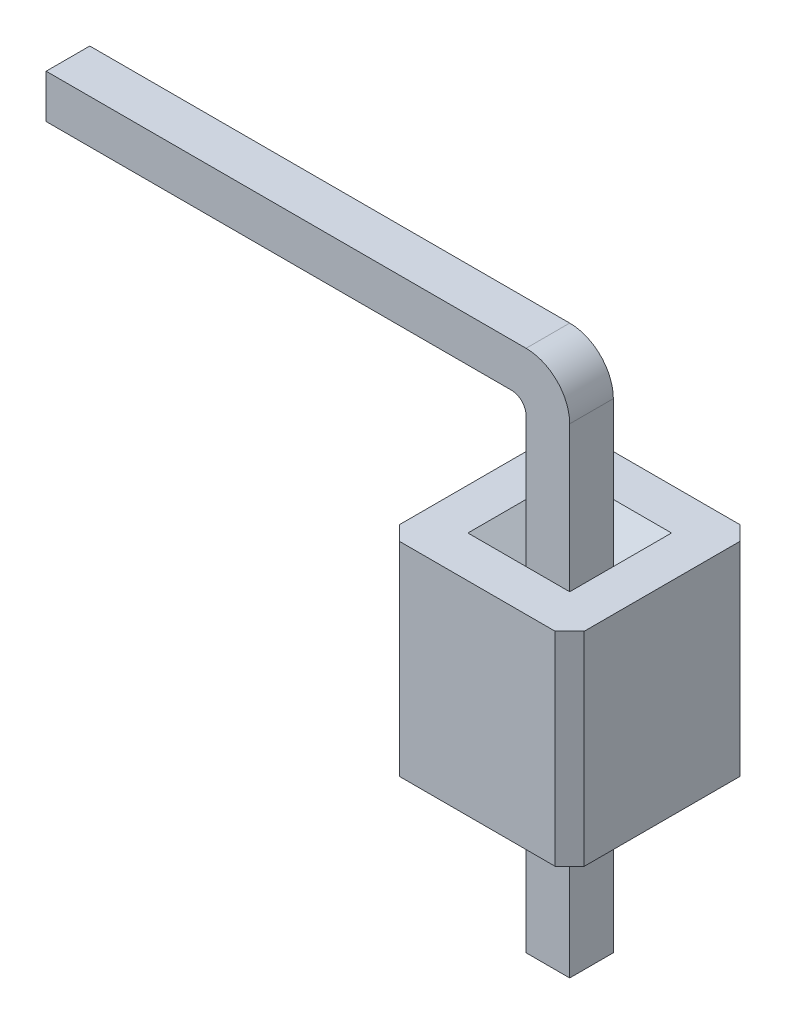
SolidWorks part; units mm, degrees
ref_plane "Plan de face" through (0, 0, 0) normal (0, 0, 1) x (1, 0, 0)
ref_plane "Plan de dessus" through (0, 0, 0) normal (0, 1, 0) x (1, 0, 0)
ref_plane "Plan de droite" through (0, 0, 0) normal (1, 0, 0) x (0, 0, -1)
sketch "Esquisse1" plane through (0, 0, 0) normal (0, 1, 0) x (1, 0, 0)
  line L1 (-0.3, 0.3) -> (0.3, 0.3)
  line L2 (-0.3, 0.3) -> (-0.3, -0.3)
  line L3 (-0.3, -0.3) -> (0.3, -0.3)
  line L4 (0.3, 0.3) -> (0.3, -0.3)
  line L7 (1.27, 1.07) -> (1.27, -1.07)
  line L9 (-1.07, 1.27) -> (1.07, 1.27)
  line L10 (-1.27, 1.07) -> (-1.27, -1.07)
  line L12 (1.07, 1.27) -> (1.27, 1.07)
  line L13 (-1.07, 1.27) -> (-1.27, 1.07)
  line L14 (-1.27, -1.07) -> (-1.07, -1.27)
  line L15 (1.27, -1.07) -> (1.07, -1.27)
  line L16 (-1.07, -1.27) -> (1.07, -1.27)
  dimension "D1" = 0.6
  dimension "D2" = 0.6
extrude "Extrusion1" add sketch "Esquisse1" along normal blind 2.8
chamfer "Chanfrein1" distance 0.4 angle 45 4 edges at (-0.3, 2.8, 0) (0, 2.8, 0.3) (0.3, 2.8, 0) (0, 2.8, -0.3)
sketch "Esquisse2" plane through (0, 2.8, 0) normal (0, -1, 0) x (1, 0, 0)
  line L1 (0.3, 0.3) -> (-0.3, 0.3)
  line L2 (0.3, 0.3) -> (0.3, -0.3)
  line L3 (0.3, -0.3) -> (-0.3, -0.3)
  line L4 (-0.3, 0.3) -> (-0.3, -0.3)
extrude "Extrusion2" add sketch "Esquisse2" along normal blind 5 and the other way blind 2.2
sketch "Esquisse3" plane through (-0.3, 0, 0) normal (-1, 0, 0) x (0, 0, 1)
  line L0 (0.3, 2.4) -> (0.3, 5) construction
  line L1 (-0.3, 5) -> (0.3, 5)
  line L2 (-0.3, 5) -> (-0.3, 4.4)
  line L3 (-0.3, 4.4) -> (0.3, 4.4)
  line L4 (0.3, 5) -> (0.3, 4.4)
  dimension "D1" = 0.6
extrude "Extrusion3" add sketch "Esquisse3" along normal blind 6.6
fillet "Congé1" radius 0.6 1 edges at (0.3, 5, 0)
fillet "Congé2" radius 0.2 1 edges at (-0.3, 4.4, 0)
